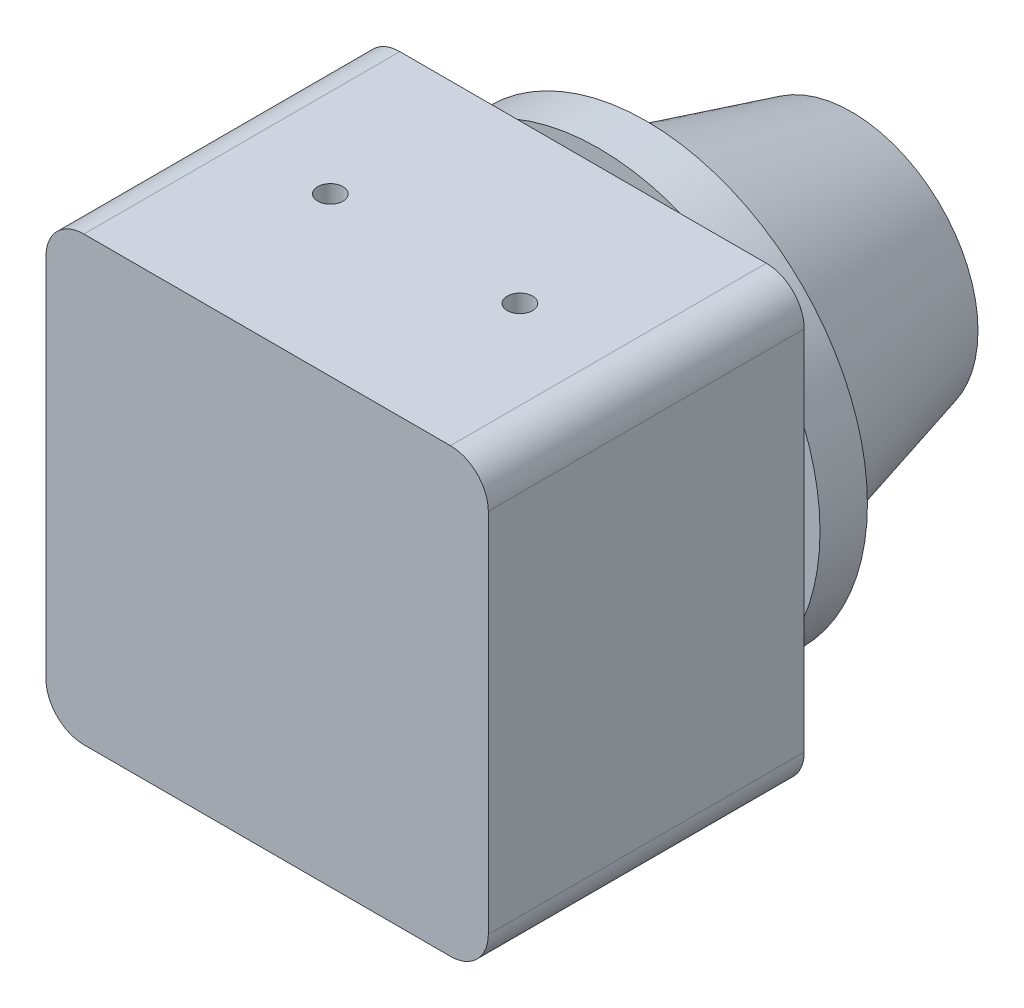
SolidWorks part; units mm, degrees
ref_plane "Plane1" through (0, 0, 0) normal (0, 0, 1) x (1, 0, 0)
ref_plane "Plane2" through (0, 0, 0) normal (0, 1, 0) x (1, 0, 0)
ref_plane "Plane3" through (0, 0, 0) normal (1, 0, 0) x (0, 0, -1)
sketch "Sketch1" plane through (0, 0, 0) normal (0, 0, 1) x (1, 0, 0)
  line L0 (117.475, 149.225) -> (161.925, 104.775) construction
  line L1 (158.115, 149.225) -> (121.285, 149.225)
  line L2 (161.925, 145.415) -> (161.925, 108.585)
  line L3 (158.115, 104.775) -> (121.285, 104.775)
  line L4 (117.475, 145.415) -> (117.475, 108.585)
  arc A1 (161.925, 145.415) -> (158.115, 149.225) centre (158.115, 145.415) ccw
  arc A2 (117.475, 145.415) -> (121.285, 149.225) centre (121.285, 145.415) cw
  arc A3 (121.285, 104.775) -> (117.475, 108.585) centre (121.285, 108.585) cw
  arc A4 (158.115, 104.775) -> (161.925, 108.585) centre (158.115, 108.585) ccw
  point P6 (139.7, 127)
  dimension "D1" = 3.81
  dimension "D2" = 44.45
extrude "Extrude1" add sketch "Sketch1" along normal blind 31.75
ref_plane "Plane4" through (139.7, 0, 0) normal (1, 0, 0) x (0, 0, -1)
sketch "Sketch2" plane through (139.7, 0, 0) normal (1, 0, 0) x (0, 0, -1)
  line L0 (0, 127) -> (31.8453, 127) construction
  line L2 (0, 108.585) -> (0, 145.415) construction
  line L3 (0, 127) -> (0, 140.97)
  line L5 (0, 127) -> (26.9875, 127)
  line L7 (1.5875, 140.97) -> (0, 140.97)
  line L8 (26.9875, 127) -> (26.9875, 139.7)
  line L9 (26.9875, 139.7) -> (6.35, 145.2298)
  line L10 (6.35, 145.2298) -> (6.35, 149.225)
  line L11 (6.35, 149.225) -> (1.5875, 149.225)
  line L12 (1.5875, 149.225) -> (1.5875, 140.97)
  dimension "D2" = 25.4
  dimension "D3" = 44.45
  dimension "D4" = 25.4
  dimension "D5" = 4.7625
  dimension "D6" = 105
revolve "Revolve1" add sketch "Sketch2" angle 360 about L0
sketch "Sketch4" plane through (0, 149.225, 0) normal (0, 1, 0) x (-1, 0, 0)
  line L0 (-121.285, 31.75) -> (-121.285, 0) construction
  line L1 (-158.115, 0) -> (-121.285, 0) construction
  circle A0 centre (-130.175, 15.875) radius 1.27
  circle A1 centre (-149.225, 15.875) radius 1.27
  dimension "D1" = 2.54
  dimension "D2" = 8.89
  dimension "D3" = 27.94
  dimension "D4" = 15.875
extrude "Cut-Extrude2" cut sketch "Sketch4" against normal through all
